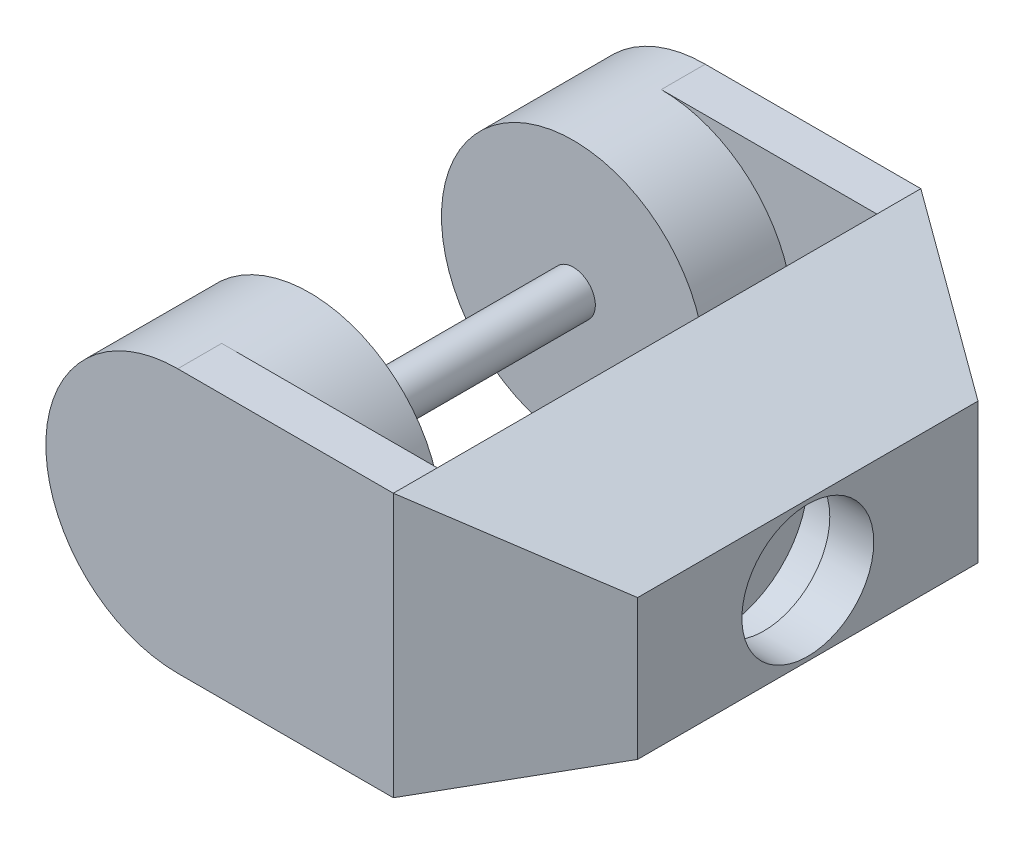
SolidWorks part; units mm, degrees
ref_plane "Front Plane" through (0, 0, 0) normal (0, 0, 1) x (1, 0, 0)
ref_plane "Top Plane" through (0, 0, 0) normal (0, 1, 0) x (1, 0, 0)
ref_plane "Right Plane" through (0, 0, 0) normal (1, 0, 0) x (0, 0, -1)
sketch "Sketch1" plane through (0, 0, 0) normal (0, 0, 1) x (1, 0, 0)
  circle A0 centre (0, 0) radius 5
  dimension "D1" = 10
extrude "Boss-Extrude1" add sketch "Sketch1" along normal mid plane 60
sketch "Sketch2" plane through (0, 0, 30) normal (0, 0, 1) x (1, 0, 0)
  circle A0 centre (0, 0) radius 30
  dimension "D1" = 60
extrude "Boss-Extrude2" add sketch "Sketch2" along normal blind 20
mirror "Mirror1" about plane through (0, 0, 0) normal (0, 0, 1) of "Boss-Extrude2"
sketch "Sketch5" plane through (0, 0, 50) normal (0, 0, 1) x (1, 0, 0)
  line L0 (49.0469, 30) -> (49.0469, -30)
  line L1 (0, -30) -> (49.0469, -30)
  line L2 (0, 30) -> (49.0469, 30)
  circle A1 centre (0, 0) radius 30
  arc A2 (0, 30) -> (0, -30) centre (0, 0) ccw
  dimension "D1" = 0
extrude "Boss-Extrude3" add sketch "Sketch5" along normal blind 10
mirror "Mirror3" about plane through (0, 0, 0) normal (0, 0, 1) of "Boss-Extrude3"
sketch "Sketch6" plane through (0, 0, 0) normal (0, 0, 1) x (1, 0, 0)
  line L0 (42.0872, 0) -> (83.3346, 0) construction
  line L1 (49.0469, -30) -> (49.0469, 30)
  line L2 (49.0469, -30) -> (49.0469, 30) construction
  line L3 (49.0469, 30) -> (83.3346, 15.9427)
  line L4 (83.3346, 15.9427) -> (83.3346, -15.9427)
  line L5 (49.0469, -30) -> (83.3346, -15.9427)
  point P11 (49.0469, 0)
extrude "Boss-Extrude4" add sketch "Sketch6" along normal mid plane 120
sketch "Sketch7" plane through (0, 0, 0) normal (0, 1, 0) x (1, 0, 0)
  line L0 (49.0469, 60) -> (92.2408, 33.1866)
extrude "Cut-Extrude2" cut sketch "Sketch7" against normal through all and the other way through all
mirror "Mirror4" about plane through (0, 0, 0) normal (0, 0, 1) of "Cut-Extrude2"
sketch "Sketch8" plane through (83.3346, 0, 0) normal (1, 0, 0) x (0, 0, -1)
  circle A0 centre (0, 0) radius 15
  dimension "D1" = 30
extrude "Cut-Extrude3" cut sketch "Sketch8" against normal blind 10
sketch "Sketch9" plane through (73.3346, 0, 0) normal (1, 0, 0) x (0, 0, -1)
  circle A2 centre (0, 0) radius 20
  circle A3 centre (0, 0) radius 20
  dimension "D1" = 5
extrude "Cut-Extrude4" cut sketch "Sketch9" against normal blind 10
